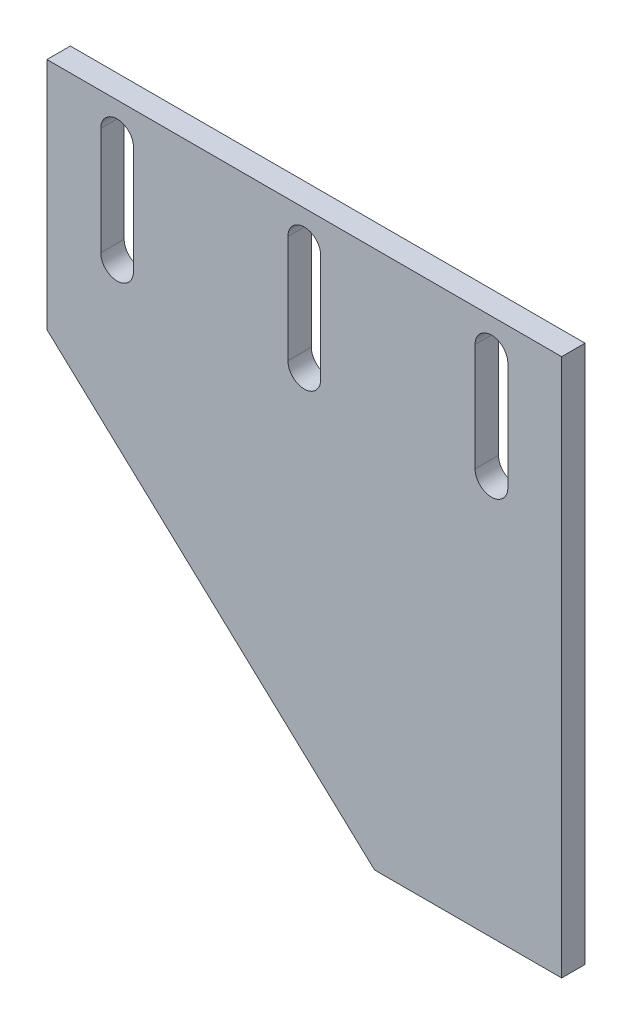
SolidWorks part; units mm, degrees
ref_plane "Face" through (0, 0, 0) normal (0, 0, 1) x (1, 0, 0)
ref_plane "Dessus" through (0, 0, 0) normal (0, 1, 0) x (1, 0, 0)
ref_plane "Droite" through (0, 0, 0) normal (1, 0, 0) x (0, 0, -1)
sketch "Esquisse1" plane through (0, 0, 0) normal (0, 0, 1) x (1, 0, 0)
  line L0 (-110, 15) -> (30, -115)
  line L1 (-110, 115) -> (110, 115)
  line L2 (-110, 115) -> (-110, 15)
  line L3 (30, -115) -> (110, -115)
  line L4 (110, 115) -> (110, -115)
  line L5 (87, 101) -> (87, 55)
  line L6 (73, 101) -> (73, 55)
  line L7 (7, 101) -> (7, 55)
  line L8 (-7, 101) -> (-7, 55)
  line L9 (-73, 101) -> (-73, 55)
  line L10 (-87, 101) -> (-87, 55)
  arc A0 (87, 101) -> (73, 101) centre (80, 101) ccw
  arc A1 (-87, 55) -> (-73, 55) centre (-80, 55) ccw
  arc A2 (7, 101) -> (-7, 101) centre (0, 101) ccw
  arc A3 (-7, 55) -> (7, 55) centre (0, 55) ccw
  arc A4 (-73, 101) -> (-87, 101) centre (-80, 101) ccw
  arc A5 (73, 55) -> (87, 55) centre (80, 55) ccw
  dimension "D5" = 100
  dimension "D6" = 80
  dimension "D7" = 30
  dimension "D8" = 60
  dimension "D14" = 14
  dimension "D16" = 14
  dimension "D9" = 60
  dimension "D10" = 60
  dimension "D11" = 80
  dimension "D13" = 14
  dimension "D15" = 14
  dimension "D17" = 14
  dimension "D18" = 14
  dimension "D1" = 220
  dimension "D2" = 110
  dimension "D3" = 230
  dimension "D4" = 115
  dimension "D12" = 80
  dimension "D19" = 46
extrude "Extrusion1" add sketch "Esquisse1" along normal blind 10
